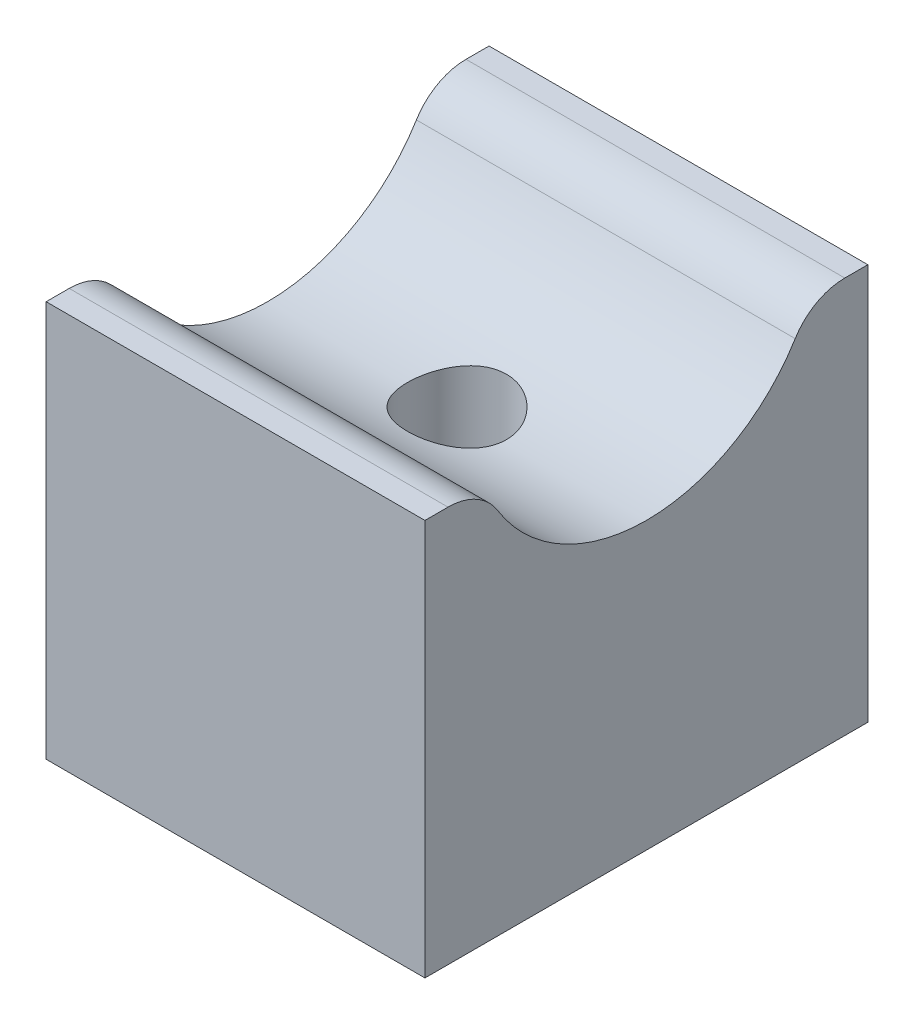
SolidWorks part; units mm, degrees
ref_plane "Vorne" through (0, 0, 0) normal (0, 0, 1) x (1, 0, 0)
ref_plane "Oben" through (0, 0, 0) normal (0, 1, 0) x (1, 0, 0)
ref_plane "Rechts" through (0, 0, 0) normal (1, 0, 0) x (0, 0, -1)
sketch "Skizze2" plane through (0, 0, 0) normal (0, 1, 0) x (1, 0, 0)
  line L1 (-16.25, 19) -> (16.25, 19)
  line L2 (-16.25, 19) -> (-16.25, -19)
  line L3 (-16.25, -19) -> (16.25, -19)
  line L4 (16.25, 19) -> (16.25, -19)
  line L5 (-16.25, 19) -> (16.25, -19) construction
  line L6 (-16.25, -19) -> (16.25, 19) construction
  point P0 (0, 0)
  dimension "D1" = 38
  dimension "D2" = 32.5
extrude "Grundkörper" add sketch "Skizze2" along normal blind 34
sketch "Skizze3" plane through (0, 0, 0) normal (1, 0, 0) x (0, 0, -1)
  line L0 (0, 0) -> (0, 39.5) construction
  circle A0 centre (0, 39.5) radius 15
  dimension "D1" = 15
  dimension "D2" = 39.5
extrude "Schnitt-Linear austragen1" cut sketch "Skizze3" against normal through all and the other way through all
fillet "Verrundung1" radius 5 2 edges at (0, 34, 13.9553) (0, 34, -13.9553)
hole_wizard "Stirnsenkung für M8 Zylinderschraube mit Innensechskant1" positions "Skizze5" profile "Skizze4" counterbore size "M8" standard "DIN"
sketch "Skizze5" plane through (0, 0, 0) normal (0, -1, 0) x (1, 0, 0)
  point P0 (0, 0)
sketch "Skizze4" plane through (0, 0, 0) normal (1, 0, 0) x (0, 0, -1)
  line L0 (0, 0) -> (0, 34)
  line L1 (0, 34) -> (4.25, 34)
  line L3 (4.25, 34) -> (4.25, 2)
  line L4 (4.25, 2) -> (7.5, 2)
  line L5 (7.5, 2) -> (7.5, 0)
  line L7 (7.5, 0) -> (0, 0)
  line L11 (0, -6.35) -> (0, 107.95) construction
  dimension "Bohrerdurchmesser" = 8.5
  dimension "Bohrungstiefe" = 34
  dimension "Senkdurchmesser2" = 15
  dimension "Senktiefe2" = 2
